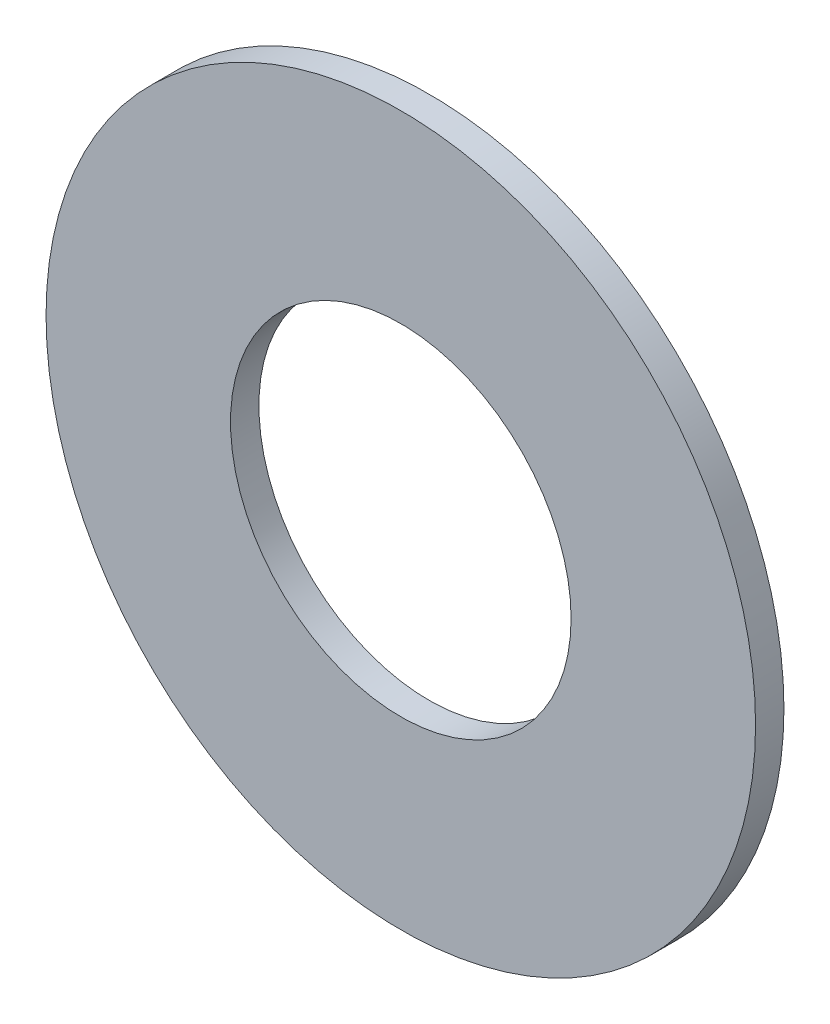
SolidWorks part; units mm, degrees
ref_plane "Face" through (0, 0, 0) normal (0, 0, 1) x (1, 0, 0)
ref_plane "Dessus" through (0, 0, 0) normal (0, 1, 0) x (1, 0, 0)
ref_plane "Droite" through (0, 0, 0) normal (1, 0, 0) x (0, 0, -1)
sketch "Esquisse1" plane through (0, 0, 0) normal (0, 0, 1) x (1, 0, 0)
  circle A0 centre (0, 0) radius 60
  circle A2 centre (0, 0) radius 125
  dimension "D1" = 250
  dimension "D2" = 120
extrude "Extrusion1" add sketch "Esquisse1" along normal blind 10
